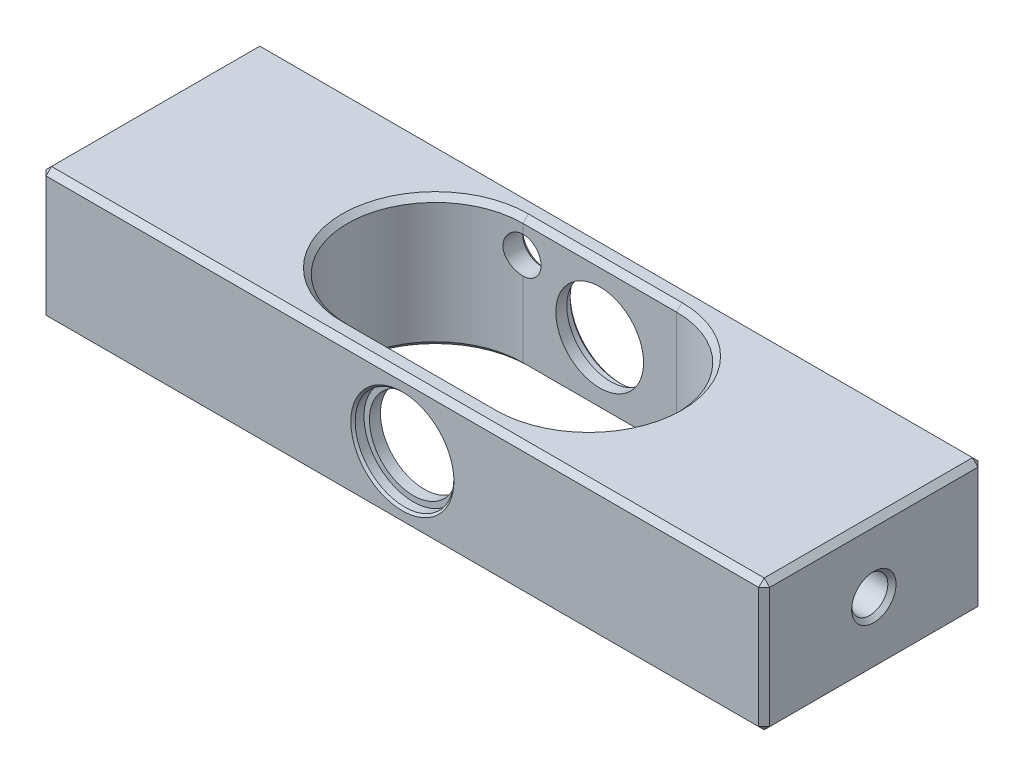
SolidWorks part; units mm, degrees
ref_plane "Front" through (0, 0, 0) normal (0, 0, 1) x (1, 0, 0)
ref_plane "Top" through (0, 0, 0) normal (0, 1, 0) x (1, 0, 0)
ref_plane "Right" through (0, 0, 0) normal (1, 0, 0) x (0, 0, -1)
sketch "Эскиз1" plane through (0, 0, 0) normal (0, 1, 0) x (1, 0, 0)
  line L1 (0, 0) -> (66, 0)
  line L2 (0, 0) -> (0, 20)
  line L3 (0, 20) -> (66, 20)
  line L4 (66, 0) -> (66, 20)
  dimension "D1" = 66
  dimension "D2" = 20
extrude "Бобышка-Вытянуть1" add sketch "Эскиз1" along normal blind 12
sketch "Эскиз3" plane through (0, 12, 0) normal (0, 1, 0) x (1, 0, 0)
  line L0 (40, 18) -> (26, 18)
  line L1 (26, 2) -> (40, 2)
  line L2 (0, 0) -> (66, 0) construction
  line L3 (66, 0) -> (66, 20) construction
  arc A0 (26, 18) -> (26, 2) centre (26, 10) ccw
  arc A1 (40, 2) -> (40, 18) centre (40, 10) ccw
  dimension "D1" = 16
  dimension "D3" = 14
  dimension "D2" = 2
  dimension "D4" = 26
extrude "Вырез-Вытянуть1" cut sketch "Эскиз3" against normal through all
chamfer "Фаска1" distance 0.5 angle 45 20 edges at (33, 0, -2) (18, 0, -10) (33, 0, -18) (48, 0, -10) (0, 0, -10) (0, 6, -20) (33, 0, -20) (66, 6, -20) (66, 0, -10) (0, 6, 0) (33, 0, 0) (66, 6, 0) (33, 12, -20) (66, 12, -10) (33, 12, 0) (0, 12, -10) (18, 12, -10) (33, 12, -2) (48, 12, -10) (33, 12, -18)
sketch "Эскиз4" plane through (0, 0, -20) normal (0, 0, -1) x (-1, 0, 0)
  line L1 (-66, 0.5) -> (-66, 11.5) construction
  line L2 (-0.5, 0) -> (-65.5, 0) construction
  circle A0 centre (-33, 6) radius 4
  dimension "D1" = 6
  dimension "D2" = 33
extrude "Вырез-Вытянуть2" cut sketch "Эскиз4" against normal through all
sketch "Эскиз5" plane through (0, 0, 0) normal (0, 0, 1) x (1, 0, 0)
  circle A0 centre (33, 6) radius 4.5
  dimension "D1" = 9
extrude "Вырез-Вытянуть3" cut sketch "Эскиз5" against normal blind 1
sketch "Эскиз6" plane through (0, 0, -20) normal (0, 0, -1) x (-1, 0, 0)
  circle A0 centre (-33, 6) radius 4.5
  dimension "D1" = 9
extrude "Вырез-Вытянуть4" cut sketch "Эскиз6" against normal blind 1
hole_wizard "Отверстие обработанное метчиком M4x0.72" positions "Эскиз10" profile "Эскиз9" tap size "M4x0.7" standard "Ansi (метрические)"
sketch "Эскиз10" plane through (0, 0, 0) normal (-1, 0, 0) x (0, 0, 1)
  line L0 (-0.5, 0) -> (-19.5, 0) construction
  line L1 (-20, 0.5) -> (-20, 11.5) construction
  point P0 (-10, 6)
  dimension "D1" = 6
  dimension "D2" = 10
sketch "Эскиз9" plane through (0, 6, -10) normal (0, 1, 0) x (0, 0, 1)
  line L0 (0, 0) -> (0, 12.4914)
  line L1 (0, 12.4914) -> (1.65, 11.5)
  line L2 (1.65, 11.5) -> (1.65, 0.375)
  line L3 (1.65, 0.375) -> (2.025, 0)
  line L5 (2.025, 0) -> (0, 0)
  line L6 (-1.65, 0.375) -> (-2.025, 0) construction
  line L10 (0, 12.4914) -> (-1.65, 11.5) construction
  line L11 (0, -6.35) -> (0, 107.95) construction
  dimension "Диаметр сверла" = 3.3
  dimension "Глубина сверла" = 11.5
  dimension "Диаметр передней зенковки" = 4.05
  dimension "Угол передней зенковки" = 90
  dimension "Угол заточки сверла" = 118
hole_wizard "Отверстие обработанное метчиком M4x0.73" positions "Эскиз15" profile "Эскиз14" tap size "M4x0.7" standard "Ansi (метрические)"
sketch "Эскиз15" plane through (66, 0, 0) normal (1, 0, 0) x (0, 0, -1)
  line L0 (0, 0.5) -> (0, 11.5) construction
  line L1 (19.5, 0) -> (0.5, 0) construction
  point P0 (10, 6)
  dimension "D1" = 10
  dimension "D2" = 6
sketch "Эскиз14" plane through (66, 6, -10) normal (0, 1, 0) x (0, 0, -1)
  line L0 (0, 0) -> (0, 12.4914)
  line L1 (0, 12.4914) -> (1.65, 11.5)
  line L2 (1.65, 11.5) -> (1.65, 0.375)
  line L3 (1.65, 0.375) -> (2.025, 0)
  line L5 (2.025, 0) -> (0, 0)
  line L6 (-1.65, 0.375) -> (-2.025, 0) construction
  line L10 (0, 12.4914) -> (-1.65, 11.5) construction
  line L11 (0, -6.35) -> (0, 107.95) construction
  dimension "Диаметр сверла" = 3.3
  dimension "Глубина сверла" = 11.5
  dimension "Диаметр передней зенковки" = 4.05
  dimension "Угол передней зенковки" = 90
  dimension "Угол заточки сверла" = 118
hole_wizard "Отверстие обработанное метчиком M4x0.75" positions "Эскиз20" profile "Эскиз21" tap size "M4x0.7" standard "Ansi (метрические)"
sketch "Эскиз20" plane through (0, 0, -20) normal (0, 0, -1) x (-1, 0, 0)
  line L0 (-26, 0.5) -> (-26, 11.5) construction
  line L1 (-65.5, 12) -> (-0.5, 12) construction
  point P0 (-26, 9)
  dimension "D1" = 3
sketch "Эскиз21" plane through (26, 9, -20) normal (1, 0, 0) x (0, 1, 0)
  line L0 (0, 0) -> (0, 3.4914)
  line L1 (0, 3.4914) -> (1.65, 2.5)
  line L2 (1.65, 2.5) -> (1.65, 0.375)
  line L3 (1.65, 0.375) -> (2.025, 0)
  line L5 (2.025, 0) -> (0, 0)
  line L6 (-1.65, 0.375) -> (-2.025, 0) construction
  line L10 (0, 3.4914) -> (-1.65, 2.5) construction
  line L11 (0, -6.35) -> (0, 107.95) construction
  dimension "Диаметр сверла" = 3.3
  dimension "Глубина сверла" = 2.5
  dimension "Диаметр передней зенковки" = 4.05
  dimension "Угол передней зенковки" = 90
  dimension "Угол заточки сверла" = 118
chamfer "Фаска2" distance 0.2 angle 45 2 edges at (28.5, 6, -20) (37.5, 6, 0)
